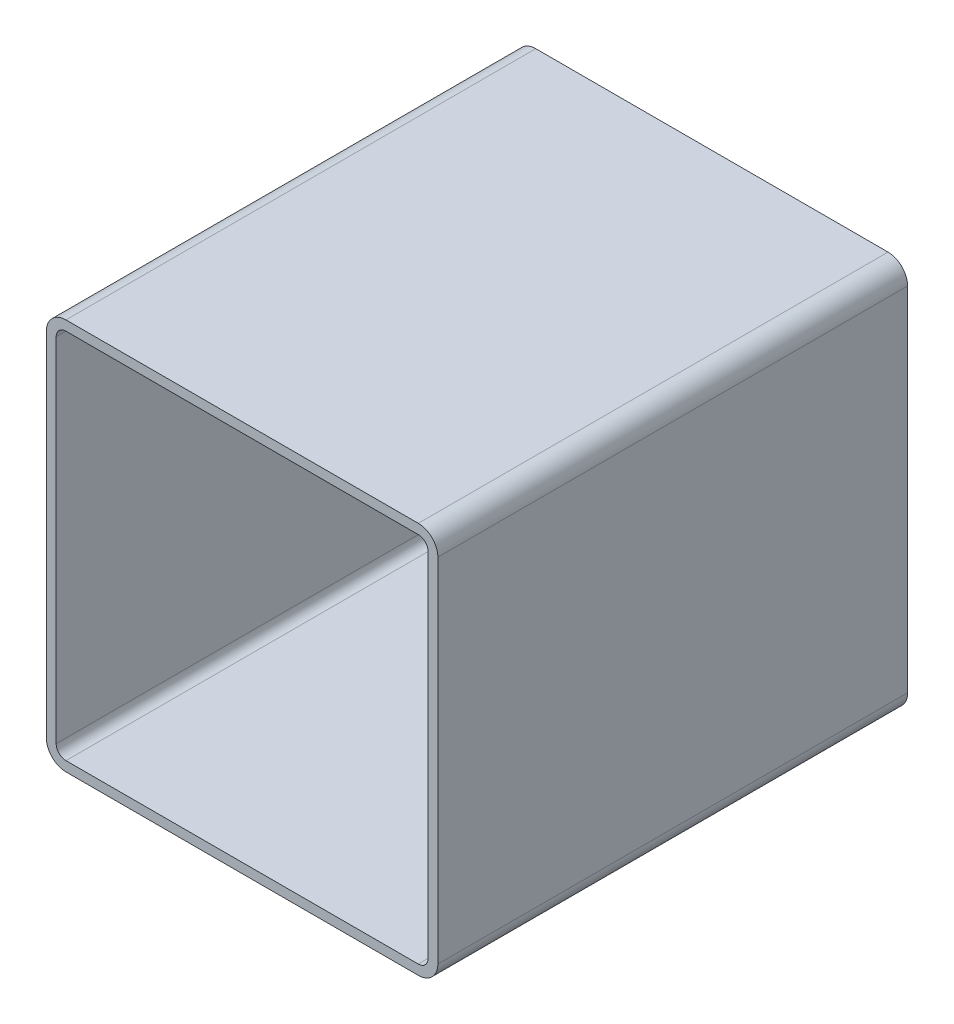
SolidWorks part; units mm, degrees
ref_plane "Front Plane" through (0, 0, 0) normal (0, 0, 1) x (1, 0, 0)
ref_plane "Top Plane" through (0, 0, 0) normal (0, 1, 0) x (1, 0, 0)
ref_plane "Right Plane" through (0, 0, 0) normal (1, 0, 0) x (0, 0, -1)
sketch "Sketch1" plane through (0, 0, 0) normal (0, 0, 1) x (1, 0, 0)
sketch_block_instance "HSS10x10x0.250-1"
sketch_block "HSS10x10x0.250"
extrude "Boss-Extrude1" add sketch "Sketch1" along normal blind 304.8
